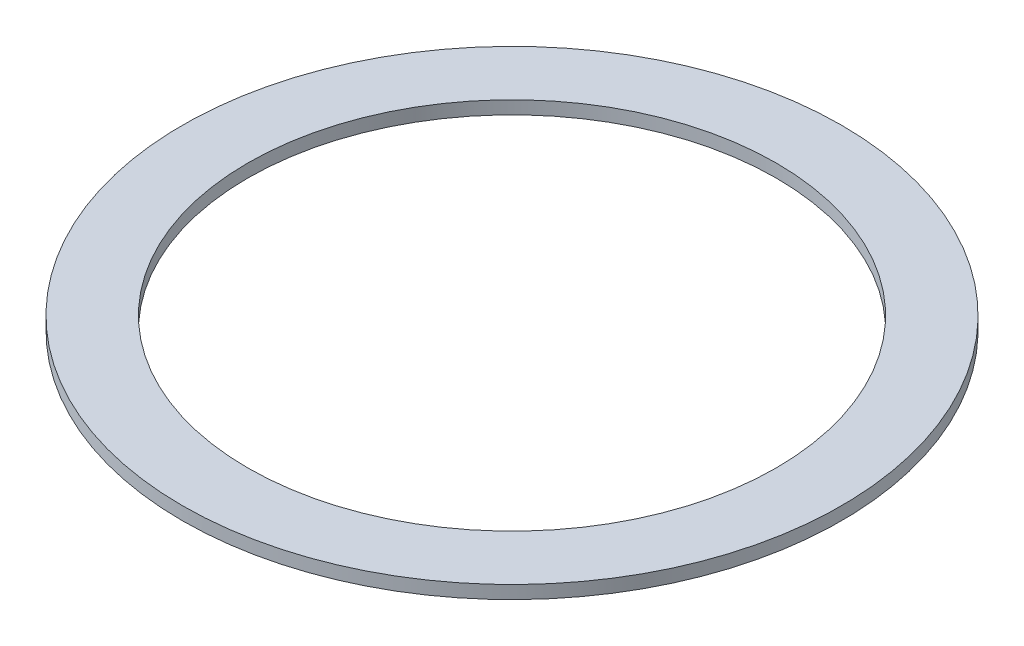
SolidWorks part; units mm, degrees
ref_plane "前视基准面" through (0, 0, 0) normal (0, 0, 1) x (1, 0, 0)
ref_plane "上视基准面" through (0, 0, 0) normal (0, 1, 0) x (1, 0, 0)
ref_plane "右视基准面" through (0, 0, 0) normal (1, 0, 0) x (0, 0, -1)
sketch "草图1" plane through (0, 0, 0) normal (0, 1, 0) x (1, 0, 0)
  circle A0 centre (0, 0) radius 40.4
  circle A1 centre (0, 0) radius 50.4
  dimension "D1" = 80.8
  dimension "D2" = 100.8
extrude "凸台-拉伸1" add sketch "草图1" along normal blind 2
